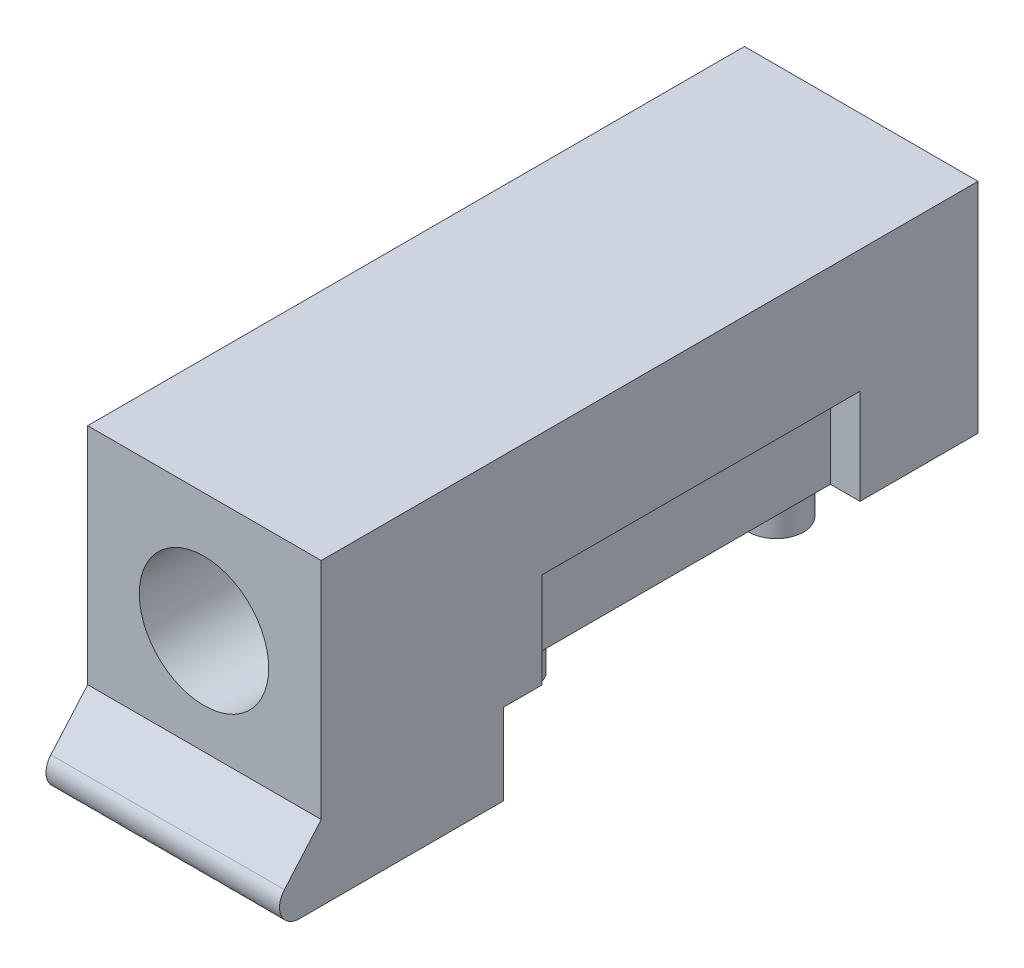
SolidWorks part; units mm, degrees
ref_plane "Front Plane" through (0, 0, 0) normal (0, 0, 1) x (1, 0, 0)
ref_plane "Top Plane" through (0, 0, 0) normal (0, 1, 0) x (1, 0, 0)
ref_plane "Right Plane" through (0, 0, 0) normal (1, 0, 0) x (0, 0, -1)
imported_body "Imported1"
sketch "Sketch1" plane through (0, 0, -31.68) normal (0, 0, 1) x (1, 0, 0)
  circle A0 centre (0, 5.9944) radius 4.041
extrude "Boss-Extrude1" add sketch "Sketch1" against normal up to surface (29.95 mm away)
sketch "Sketch2" plane through (-5.305, 0, 0) normal (-1, 0, 0) x (0, 0, 1)
  line L0 (-31.68, -0.2778) -> (-31.68, 11.2778) construction
  line L1 (-31.68, 7.4478) -> (-27.5359, 7.4478)
  line L2 (-31.68, 7.4478) -> (-31.68, 15.795)
  line L3 (-31.68, 15.795) -> (-27.5359, 15.795)
  line L4 (-27.5359, 7.4478) -> (-27.5359, 15.795)
extrude "Cut-Extrude1" cut sketch "Sketch2" against normal through all
sketch "Sketch3" plane through (-5.305, 0, 0) normal (-1, 0, 0) x (0, 0, 1)
  line L1 (-68.2273, 16.8697) -> (-28.6448, 16.8697)
  line L2 (-68.2273, 16.8697) -> (-68.2273, 9.95)
  line L3 (-68.2273, 9.95) -> (-28.6448, 9.95)
  line L4 (-28.6448, 16.8697) -> (-28.6448, 9.95)
  line L6 (-41.75, 0) -> (-40, 0) construction
  dimension "D1" = 9.95
extrude "Cut-Extrude2" cut sketch "Sketch3" against normal up to next
sketch "Sketch4" plane through (0, 0, -61.63) normal (0, 0, -1) x (-1, 0, 0)
  line L0 (5.305, 0) -> (-5.345, 0) construction
  circle A0 centre (0, 4.5) radius 2.95
  dimension "D1" = 5.9
  dimension "D2" = 4.5
extrude "Cut-Extrude3" cut sketch "Sketch4" against normal through all
sketch "Sketch5" plane through (3.995, 0, 0) normal (1, 0, 0) x (0, 0, -1)
  line L1 (61.63, 0) -> (42.8229, 0)
  line L2 (61.63, 0) -> (61.63, -4.1874)
  line L3 (61.63, -4.1874) -> (42.8229, -4.1874)
  line L4 (42.8229, 0) -> (42.8229, -4.1874)
extrude "Cut-Extrude4" cut sketch "Sketch5" against normal through all
sketch "Sketch6" plane through (0, 0, 0) normal (0, -1, 0) x (1, 0, 0)
  circle A0 centre (0, -45.4908) radius 3.3487
  circle A1 centre (0, -57.8044) radius 3.3947
  circle A2 centre (0, -51.1292) radius 2.1438
extrude "Boss-Extrude2" add sketch "Sketch6" against normal up to next
sketch "Sketch7" plane through (0, 0, 0) normal (0, -1, 0) x (1, 0, 0)
  line L0 (-5.305, -61.63) -> (-5.305, -56.25) construction
  line L1 (5.345, -40) -> (-5.305, -40) construction
  circle A0 centre (0.02, -45.5) radius 1.25
  circle A1 centre (0.02, -57.75) radius 1.25
  point P8 (0.02, -40)
  dimension "D1" = 12.25
  dimension "D2" = 2.5
  dimension "D3" = 2.5
  dimension "D4" = 5.325
  dimension "D5" = 5.5
extrude "Boss-Extrude3" add sketch "Sketch7" along normal blind 4
sketch "Sketch8" plane through (0, 0, 0) normal (0, -1, 0) x (1, 0, 0)
  circle A0 centre (0, -51.13) radius 1
  circle A1 centre (0.02, -45.5) radius 1.25 construction
  dimension "D1" = 5.63
  dimension "D2" = 2
extrude "Cut-Extrude5" cut sketch "Sketch8" against normal blind 4
